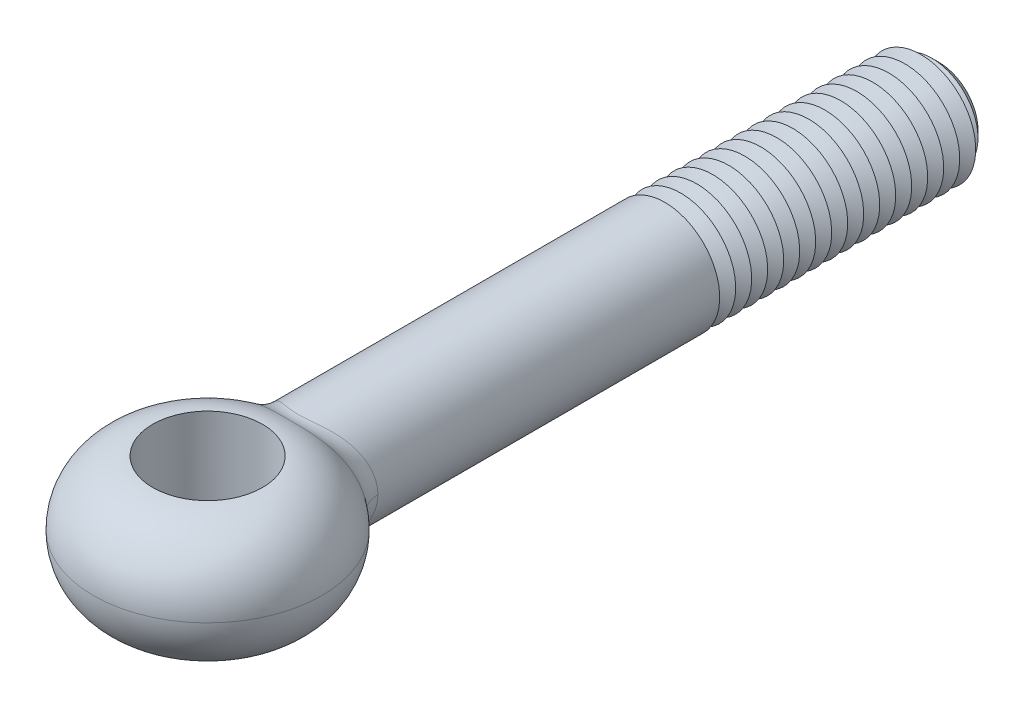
SolidWorks part; units mm, degrees
ref_plane "Front Plane" through (0, 0, 0) normal (0, 0, 1) x (1, 0, 0)
ref_plane "Top Plane" through (0, 0, 0) normal (0, 1, 0) x (1, 0, 0)
ref_plane "Right Plane" through (0, 0, 0) normal (1, 0, 0) x (0, 0, -1)
sketch "Sketch7" plane through (0, 0, 0) normal (0, 1, 0) x (1, 0, 0)
  circle A0 centre (0, 0) radius 12.5
  dimension "D1" = 25
extrude "Boss-Extrude3" add sketch "Sketch7" along normal mid plane 14
sketch "Sketch8" plane through (0, 0, 0) normal (0, 0, 1) x (1, 0, 0)
  circle A0 centre (0, 0) radius 6
  dimension "D1" = 12
extrude "Boss-Extrude4" add sketch "Sketch8" against normal blind 80
fillet "Fillet5" radius 7 2 edges at (0, -7, 12.5) (0, 7, 12.5)
fillet "Fillet6" radius 3 2 edges at (0.1735, -5.9975, -9.1081) (-0.1735, 5.9975, -9.1081)
chamfer "Chamfer1" distance 1.75 angle 45 1 edges at (6, 0, -80)
sketch "Sketch10" plane through (0, 0, 0) normal (0, 1, 0) x (1, 0, 0)
  line L0 (0, 28.1405) -> (0, -7.9233) construction
sketch "Sketch11" plane through (0, 0, 0) normal (0, 1, 0) x (1, 0, 0)
  line L0 (-6, 50) -> (-4.4845, 50.875)
  line L1 (-6, 78.25) -> (-6, 12.6194) construction
  line L2 (-4.4845, 50.875) -> (-6, 51.75)
  line L3 (-6, 51.75) -> (-6, 50)
  line L4 (4.25, 80) -> (-4.25, 80) construction
  dimension "D1" = 1.75
  dimension "D2" = 30
revolve "Cut-Revolve1" cut sketch "Sketch11" angle 360 about L0
pattern_linear "LPattern1" count 17 spacing 1.75 along (0, 0, -1) of "Cut-Revolve1"
sketch "Sketch12" plane through (0, 0, 0) normal (0, 1, 0) x (1, 0, 0)
  circle A0 centre (0, 0) radius 6
  dimension "D1" = 12
extrude "Cut-Extrude1" cut sketch "Sketch12" against normal mid plane 14
